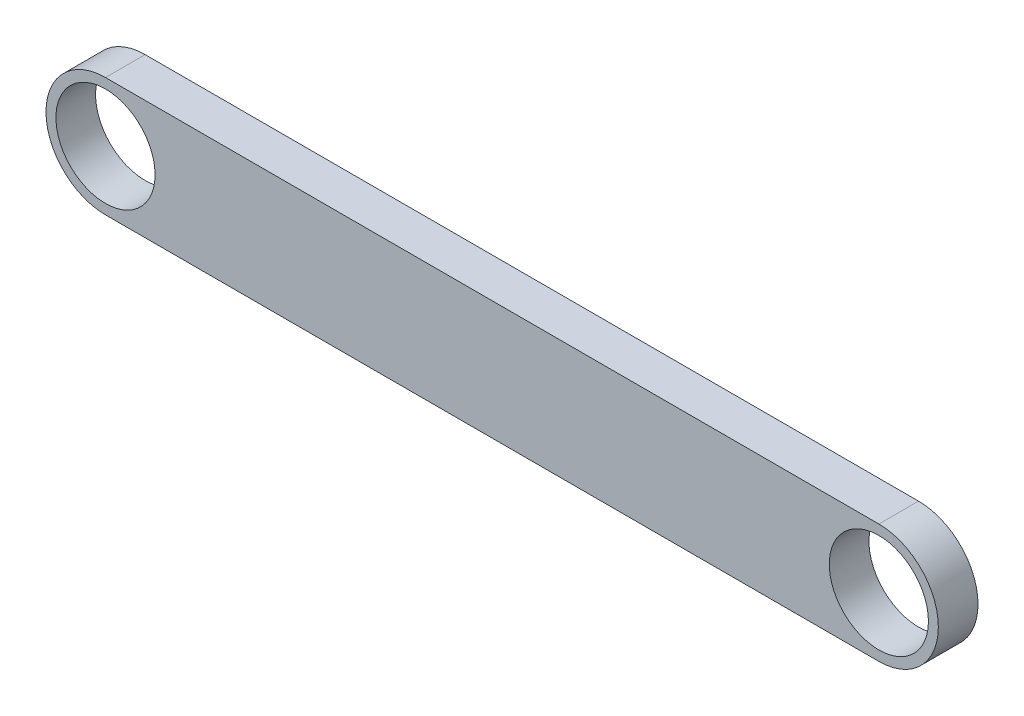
SolidWorks part; units mm, degrees
ref_plane "Front Plane" through (0, 0, 0) normal (0, 0, 1) x (1, 0, 0)
ref_plane "Top Plane" through (0, 0, 0) normal (0, 1, 0) x (1, 0, 0)
ref_plane "Right Plane" through (0, 0, 0) normal (1, 0, 0) x (0, 0, -1)
sketch "Sketch1" plane through (0, 0, 0) normal (0, 0, 1) x (1, 0, 0)
  line L0 (0, 0) -> (195, 0) construction
  line L1 (0, 15) -> (195, 15)
  line L2 (0, -15) -> (195, -15)
  arc A0 (0, 15) -> (0, -15) centre (0, 0) ccw
  arc A1 (195, -15) -> (195, 15) centre (195, 0) ccw
  circle A2 centre (0, 0) radius 12.5
  circle A3 centre (195, 0) radius 12.5
  point P3 (97.5, 0)
  dimension "D1" = 15
  dimension "D2" = 195
  dimension "D3" = 25
  dimension "D4" = 25
extrude "Boss-Extrude1" add sketch "Sketch1" along normal blind 10
